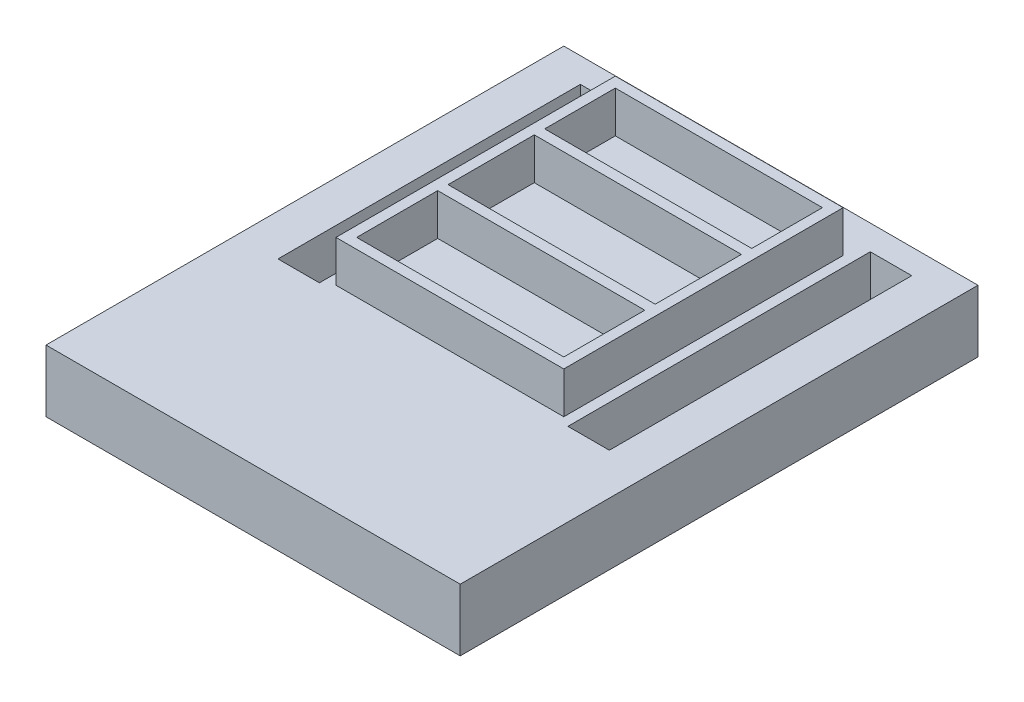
SolidWorks part; units mm, degrees
ref_plane "Front Plane" through (0, 0, 0) normal (0, 0, 1) x (1, 0, 0)
ref_plane "Top Plane" through (0, 0, 0) normal (0, 1, 0) x (1, 0, 0)
ref_plane "Right Plane" through (0, 0, 0) normal (1, 0, 0) x (0, 0, -1)
sketch "Sketch1" plane through (0, 0, 0) normal (0, 1, 0) x (1, 0, 0)
  line L1 (-100, 125) -> (100, 125)
  line L2 (-100, 125) -> (-100, -125)
  line L3 (-100, -125) -> (100, -125)
  line L4 (100, 125) -> (100, -125)
  line L5 (-100, 125) -> (100, -125) construction
  line L6 (-100, -125) -> (100, 125) construction
  point P0 (0, 0)
  dimension "D1" = 250
  dimension "D2" = 200
extrude "Boss-Extrude1" add sketch "Sketch1" along normal blind 30
sketch "Sketch3" plane through (0, 30, 0) normal (0, 1, 0) x (1, 0, 0)
  line L0 (100, 125) -> (-100, 125) construction
  line L1 (80, 113) -> (60, 113)
  line L2 (80, 113) -> (80, -33)
  line L3 (80, -33) -> (60, -33)
  line L4 (60, 113) -> (60, -33)
  line L6 (0, 0) -> (0, 103.1584) construction
  line L7 (-80, -33) -> (-60, -33)
  line L8 (-60, 113) -> (-60, -33)
  line L9 (-80, 113) -> (-60, 113)
  line L10 (-80, 113) -> (-80, -33)
  dimension "D1" = 146
  dimension "D2" = 12
  dimension "D3" = 60
  dimension "D4" = 20
extrude "Cut-Extrude1" cut sketch "Sketch3" against normal through all both and the other way through all
sketch "Sketch4" plane through (0, 30, 0) normal (0, 1, 0) x (1, 0, 0)
  line L0 (60, 113) -> (60, -33) construction
  line L1 (-50, 99.89) -> (50, 99.89)
  line L2 (-50, 99.89) -> (-50, -25)
  line L3 (-50, -25) -> (50, -25)
  line L4 (50, 99.89) -> (50, -25)
  line L5 (100, 125) -> (-100, 125) construction
  line L6 (-55, 104.89) -> (-55, -30)
  line L7 (-55, -30) -> (55, -30)
  line L8 (55, 104.89) -> (55, -30)
  line L9 (-55, 104.89) -> (55, 104.89)
  line L10 (-50, 60.76) -> (50, 60.76)
  line L11 (-50, 65.76) -> (50, 65.76)
  line L12 (-50, 19.13) -> (50, 19.13)
  line L13 (-50, 14.13) -> (50, 14.13)
  point P0 (0, 0)
  point P9 (0, -25)
  dimension "D1" = 100
  dimension "D2" = 150
  dimension "D3" = 25.11
  dimension "D4" = 10
  dimension "D6" = 64.24
  dimension "D7" = 5
  dimension "D8" = 5
  dimension "D9" = 105.87
  dimension "D5" = 5
extrude "Boss-Extrude2" add sketch "Sketch4" along normal blind 20 contours L9 L6 L7 L8 L1 L4 L3 L2 | L11 L2 L10 L4 | L2 L13 L4 L12
